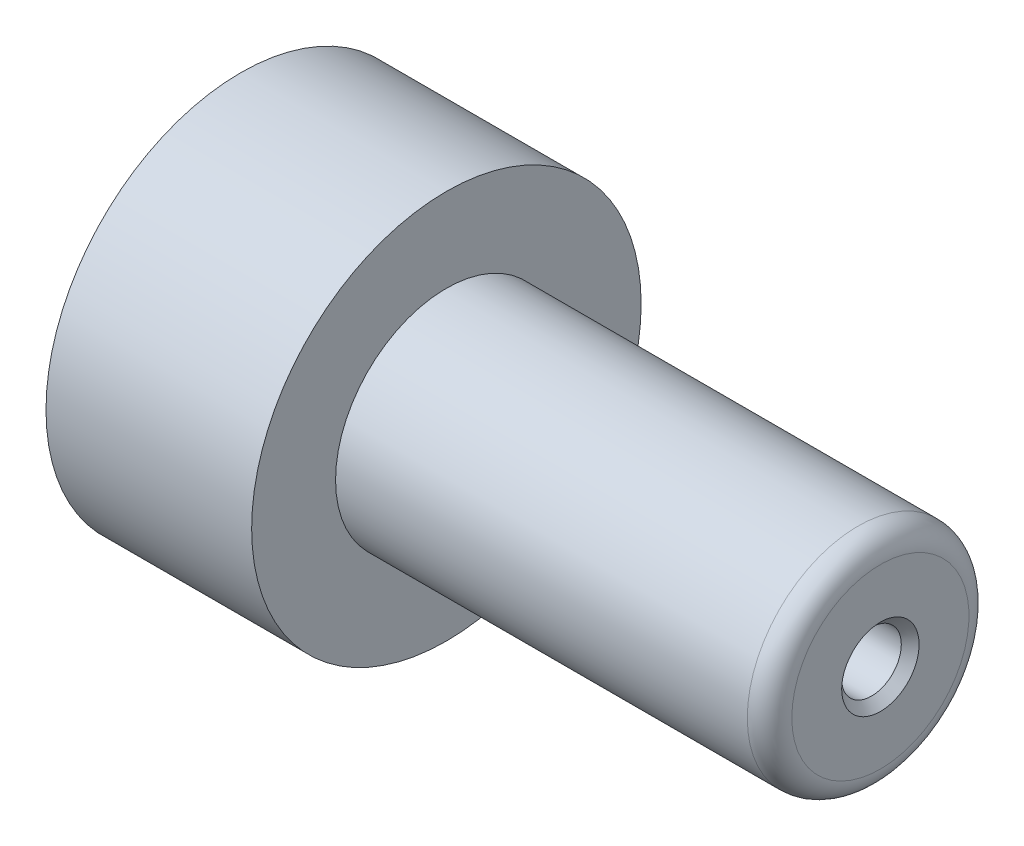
SolidWorks part; units mm, degrees
ref_plane "Front Plane" through (0, 0, 0) normal (0, 0, 1) x (1, 0, 0)
ref_plane "Top Plane" through (0, 0, 0) normal (0, 1, 0) x (1, 0, 0)
ref_plane "Right Plane" through (0, 0, 0) normal (1, 0, 0) x (0, 0, -1)
sketch "Sketch1" plane through (0, 0, 0) normal (0, 0, 1) x (1, 0, 0)
  line L0 (0, 0) -> (102.3864, 0) construction
  line L1 (0, 3.9751) -> (0, 11.1125)
  line L2 (0, 11.1125) -> (11.7348, 11.1125)
  line L3 (11.7348, 11.1125) -> (11.7348, 6.3246)
  line L4 (11.7348, 6.3246) -> (35.2298, 6.3246)
  line L5 (36.4998, 5.0546) -> (36.4998, 0)
  line L6 (36.4998, 0) -> (21.7678, 0)
  line L7 (0, 3.9751) -> (21.7678, 3.9751)
  line L8 (21.7678, 3.9751) -> (21.7678, 0)
  arc A0 (36.4998, 5.0546) -> (35.2298, 6.3246) centre (35.2298, 5.0546) ccw
  dimension "D5" = 1.27
  dimension "D1" = 11.7348
  dimension "D2" = 22.225
  dimension "D3" = 21.7678
  dimension "D4" = 7.9502
  dimension "D6" = 36.4998
  dimension "D7" = 12.6492
revolve "Revolve1" add sketch "Sketch1" angle 360 about L0
sketch "Sketch2" plane through (0, 0, 0) normal (-1, 0, 0) x (0, 0, 1)
  line L0 (0, 0) -> (9.7644, 0) construction
  circle A0 centre (0, 6.7437) radius 1.2065
  circle A1 centre (0, -6.7437) radius 1.2065
  dimension "D2" = 2.413
  dimension "D1" = 13.4874
extrude "Cut-Extrude1" cut sketch "Sketch2" against normal blind 2.54
sketch "Sketch3" plane through (36.4998, 0, 0) normal (1, 0, 0) x (0, 0, -1)
  circle A0 centre (0, 0) radius 1.7018
  dimension "D1" = 3.4036
extrude "Cut-Extrude2" cut sketch "Sketch3" against normal blind 11.0998
chamfer "Chamfer1" distance 0.508 angle 45 1 edges at (36.4998, 0, -1.7018)
